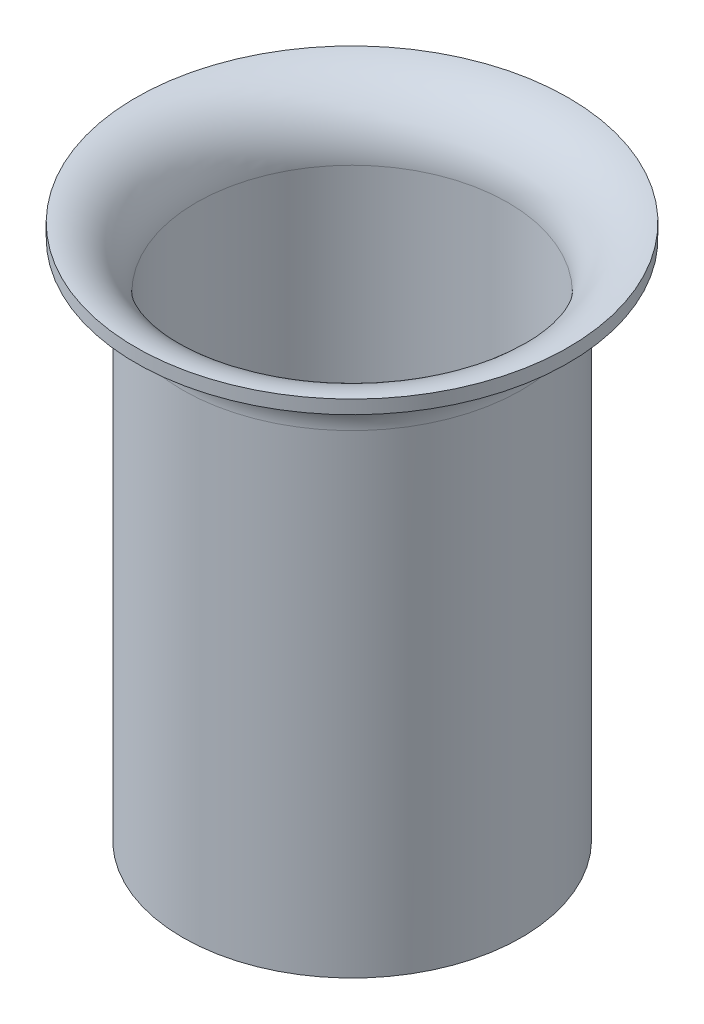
SolidWorks part; units mm, degrees
ref_plane "Front Plane" through (0, 0, 0) normal (0, 0, 1) x (1, 0, 0)
ref_plane "Top Plane" through (0, 0, 0) normal (0, 1, 0) x (1, 0, 0)
ref_plane "Right Plane" through (0, 0, 0) normal (1, 0, 0) x (0, 0, -1)
sketch "Sketch1" plane through (0, 0, 0) normal (0, 1, 0) x (1, 0, 0)
  circle A0 centre (0, 0) radius 12.5
  circle A1 centre (0, 0) radius 11.5
  dimension "D1" = 25
  dimension "D2" = 1
extrude "Extrude1" add sketch "Sketch1" along normal blind 35
sketch "Sketch2" plane through (0, 0, 0) normal (0, 0, 1) x (1, 0, 0)
  line L0 (15.968, 38.468) -> (15.968, 39.468)
  line L1 (12.5, 35) -> (11.5, 35)
  line L2 (0, 35) -> (0, 43.2275) construction
  line L3 (11.5, 35) -> (-11.5, 35) construction
  arc A0 (15.968, 38.468) -> (12.5, 35) centre (15.968, 35) ccw
  arc A1 (15.968, 39.468) -> (11.5, 35) centre (15.968, 35) ccw
  circle A2 centre (15.968, 35) radius 4.468 construction
  circle A3 centre (15.968, 35) radius 3.468 construction
  dimension "D1" = 1
revolve "Revolve1" add sketch "Sketch2" angle 360 about L2
